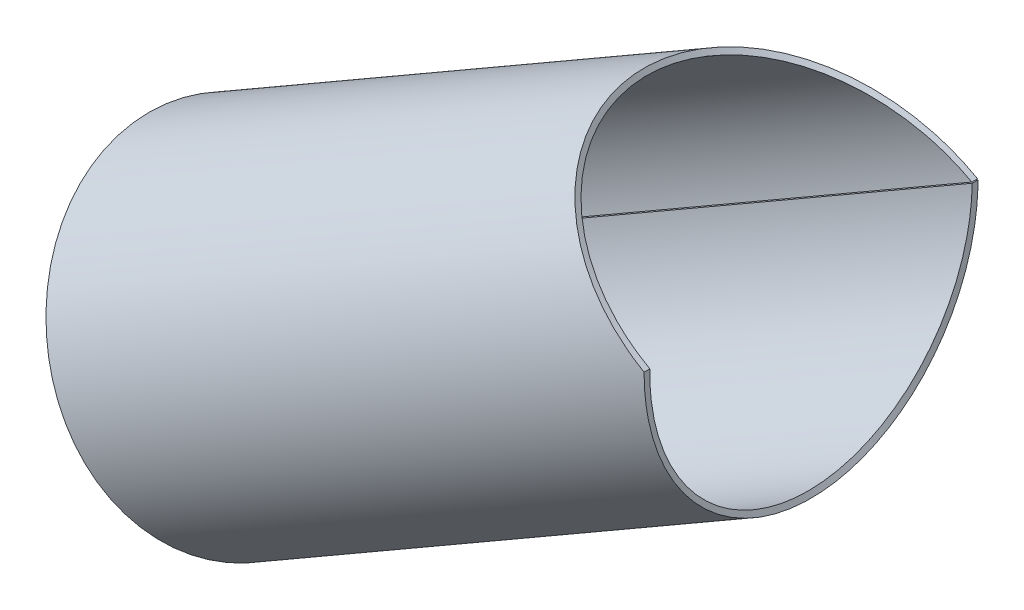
SolidWorks part; units mm, degrees
ref_plane "前视基准面" through (0, 0, 0) normal (0, 0, 1) x (1, 0, 0)
ref_plane "上视基准面" through (0, 0, 0) normal (0, 1, 0) x (1, 0, 0)
ref_plane "右视基准面" through (0, 0, 0) normal (1, 0, 0) x (0, 0, -1)
imported_body "基体零件-等角Y形管-1"
sheet metal parameters "钣金1" parameters "D1"=0.7366, "厚度"=6
bend "圆角折弯1" bend radius 169 bend angle 359.673 parameters "D5"=1
flatten bends "展开-折弯1" parameters "D1"=0
sketch "尖角-草图1" plane through (-303.4839, -174.6392, -174.9993) normal (-0.0014, 0.0025, -1) x (-1, 0, 0.0014)
  line L0 (-37.7619, 634.3077) -> (568.2065, 284.4531) construction
process bends "加工-折弯1" parameters "D1"=0
sketch "平面-草图1" plane through (-303.4839, -174.6392, -174.9993) normal (-0.0014, 0.0025, -1) x (-1, 0, 0.0014)
